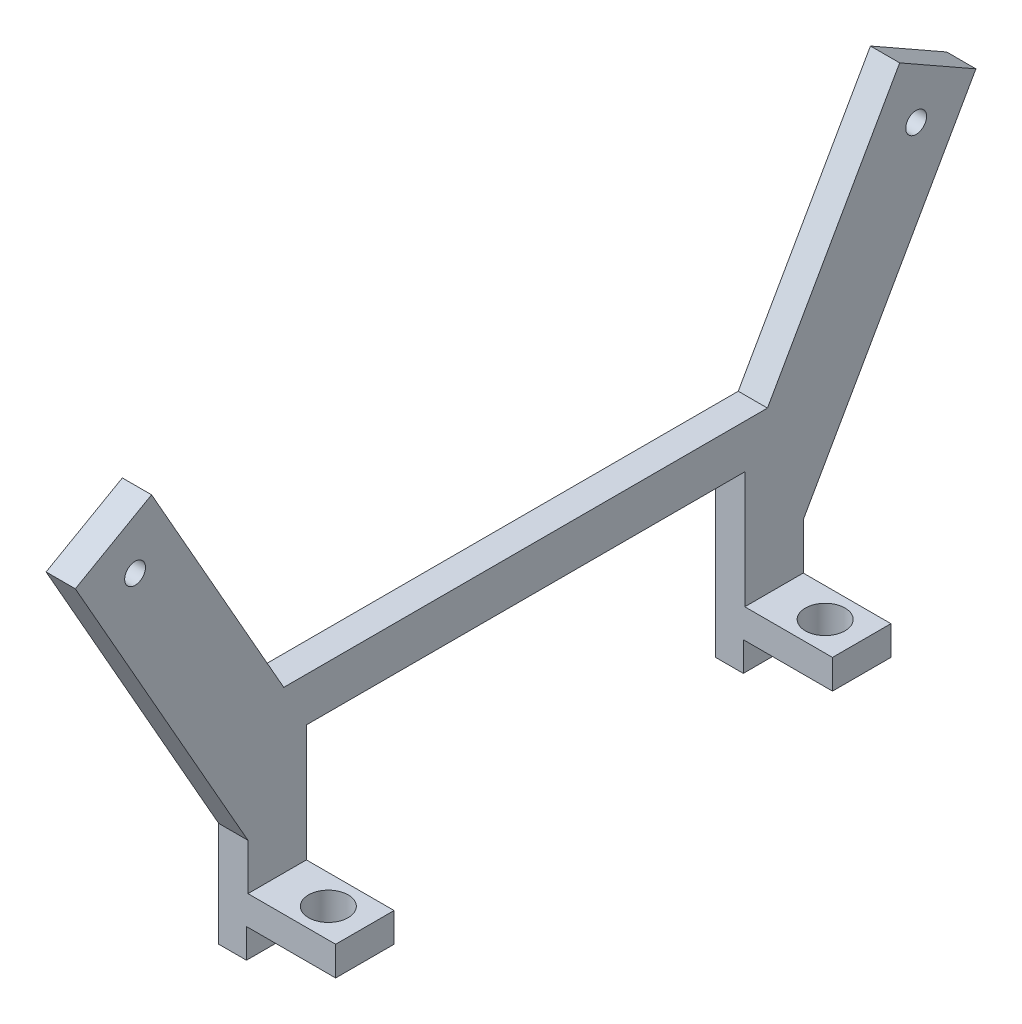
SolidWorks part; units mm, degrees
ref_plane "Front" through (0, 0, 0) normal (0, 0, 1) x (1, 0, 0)
ref_plane "Top" through (0, 0, 0) normal (0, 1, 0) x (1, 0, 0)
ref_plane "Right" through (0, 0, 0) normal (1, 0, 0) x (0, 0, -1)
sketch "Sketch2" plane through (-30, 0, 0) normal (1, 0, 0) x (0, 0, -1)
  line L0 (-48.9192, -40.6359) -> (-40.6359, -35.9336)
  line L1 (-40.6359, -35.9336) -> (-26.2743, -61.2321)
  line L2 (-31.75, -81.8696) -> (31.75, -81.8696) construction
  line L3 (-48.9192, -40.6359) -> (-30.1625, -73.6766)
  line L4 (-30.1625, -73.6766) -> (-30.1625, -81.8696)
  line L5 (-30.1625, -81.8696) -> (-23.8125, -81.8696)
  line L6 (-23.8125, -81.8696) -> (-23.8125, -65.9946)
  line L7 (-23.8125, -65.9946) -> (23.8125, -65.9946)
  line L8 (-26.2743, -61.2321) -> (26.2743, -61.2321)
  line L9 (0, 0) -> (0, -40.5913) construction
  line L10 (48.9192, -40.6359) -> (40.6359, -35.9336)
  line L11 (30.1625, -81.8696) -> (23.8125, -81.8696)
  line L12 (23.8125, -81.8696) -> (23.8125, -65.9946)
  line L13 (30.1625, -73.6766) -> (30.1625, -81.8696)
  line L14 (48.9192, -40.6359) -> (30.1625, -73.6766)
  line L15 (40.6359, -35.9336) -> (26.2743, -61.2321)
  circle A0 centre (-42.4264, -42.4264) radius 1.5 construction
  point P10 (42.4264, -42.4264)
  point P11 (-42.4264, -42.4264)
  point P24 (-26.9875, -81.8696)
  dimension "D2" = 4.7625
  dimension "D3" = 4.7625
  dimension "D1" = 9.525
  dimension "D4" = 6.35
  dimension "D5" = 4.7625
  dimension "D6" = 29.583
  dimension "D7" = 15.875
  dimension "D8" = 26.9875
  dimension "D9" = 81.8696
extrude "Extrude1" add sketch "Sketch2" along normal blind 3.175
hole_wizard "#4-40 Tapped Hole1" positions "Sketch4" profile "Sketch3" tap size "#4-40" standard "Ansi Inch"
sketch "Sketch4" plane through (-26.825, 0, 0) normal (1, 0, 0) x (0, 0, -1)
  point P1 (-42.4264, -42.4264)
  point P5 (42.4264, -42.4264)
sketch "Sketch3" plane through (-26.825, -42.4264, 42.4264) normal (0, 1, 0) x (0, 0, -1)
  line L0 (0, 0) -> (0, 3.175)
  line L1 (0, 3.175) -> (1.1303, 3.175)
  line L2 (1.1303, 3.175) -> (1.1303, 0)
  line L5 (1.1303, 0) -> (0, 0)
  line L11 (0, -6.35) -> (0, 107.95) construction
  dimension "Thru Tap Drill Dia." = 2.2606
  dimension "Thru Tap Drill Depth" = 3.175
sketch "Sketch5" plane through (0, -81.8696, 0) normal (0, -1, 0) x (1, 0, 0)
  line L1 (-30, 30.1625) -> (-26.9875, 30.1625)
  line L2 (-30, 30.1625) -> (-30, 23.8125)
  line L3 (-30, 23.8125) -> (-26.9875, 23.8125)
  line L4 (-26.9875, 30.1625) -> (-26.9875, 23.8125)
  line L6 (-30, -23.8125) -> (-26.9875, -23.8125)
  line L7 (-30, -23.8125) -> (-30, -30.1625)
  line L8 (-30, -30.1625) -> (-26.9875, -30.1625)
  line L9 (-26.9875, -23.8125) -> (-26.9875, -30.1625)
  line L14 (-26.9875, -31.75) -> (-26.9875, 31.75) construction
  line L15 (-26.825, 23.8125) -> (-30, 23.8125) construction
  line L16 (-26.825, -30.1625) -> (-30, -30.1625) construction
extrude "Extrude2" add sketch "Sketch5" along normal blind 3.175
sketch "Sketch6" plane through (-26.825, 0, 0) normal (1, 0, 0) x (0, 0, -1)
  line L0 (-23.8125, -81.8696) -> (-23.8125, -65.9946) construction
  line L1 (-30.1625, -81.8696) -> (-23.8125, -81.8696)
  line L2 (-30.1625, -81.8696) -> (-30.1625, -78.6946)
  line L3 (-30.1625, -78.6946) -> (-23.8125, -78.6946)
  line L4 (-23.8125, -81.8696) -> (-23.8125, -78.6946)
  line L5 (30.1625, -81.8696) -> (30.1625, -73.6766) construction
  line L6 (23.8125, -81.8696) -> (30.1625, -81.8696)
  line L7 (23.8125, -81.8696) -> (23.8125, -78.6946)
  line L8 (23.8125, -78.6946) -> (30.1625, -78.6946)
  line L9 (30.1625, -81.8696) -> (30.1625, -78.6946)
  dimension "D1" = 3.175
extrude "Extrude3" add sketch "Sketch6" along normal blind 9.525
hole_wizard "#18 (0.1695) Diameter Hole1" positions "Sketch8" profile "Sketch9" hole size "#18" standard "Ansi Inch"
sketch "Sketch8" plane through (0, -78.6946, 0) normal (0, 1, 0) x (-1, 0, 0)
  line L0 (17.3, -30.1625) -> (17.3, -23.8125) construction
  line L1 (17.3, -30.1625) -> (26.825, -30.1625) construction
  line L2 (17.3, 23.8125) -> (26.825, 23.8125) construction
  point P0 (21.2687, 26.9875)
  point P1 (21.2687, -26.9875)
  dimension "D1" = 3.9688
  dimension "D2" = 3.175
  dimension "D3" = 3.175
sketch "Sketch9" plane through (-21.2687, -78.6946, 26.9875) normal (1, 0, 0) x (0, 0, 1)
  line L0 (0, 0) -> (0, 6.35)
  line L1 (0, 6.35) -> (2.1526, 6.35)
  line L2 (2.1526, 6.35) -> (2.1526, 0)
  line L5 (2.1526, 0) -> (0, 0)
  line L11 (0, -6.35) -> (0, 107.95) construction
  dimension "Thru Hole Dia." = 4.3053
  dimension "Thru Hole Depth" = 6.35
